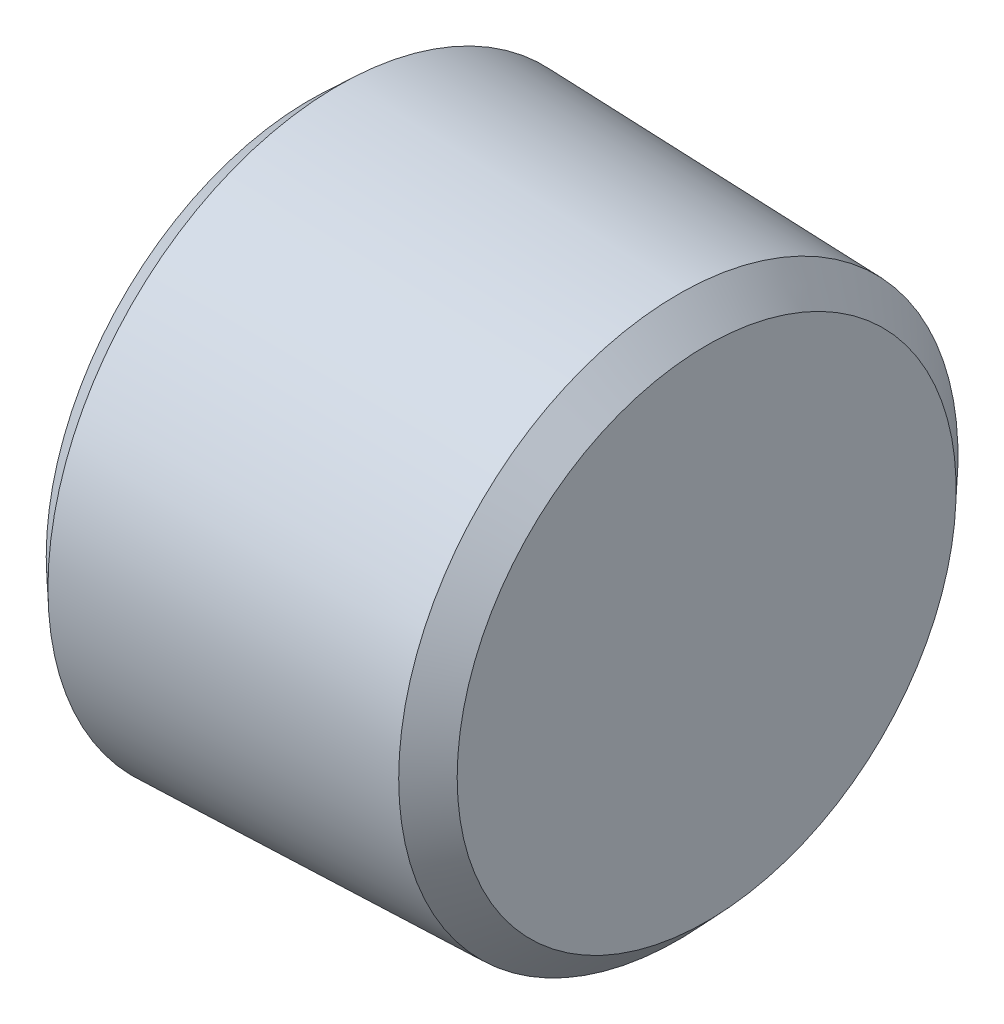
SolidWorks part; units mm, degrees
ref_plane "前视" through (0, 0, 0) normal (0, 0, 1) x (1, 0, 0)
ref_plane "上视" through (0, 0, 0) normal (0, 1, 0) x (1, 0, 0)
ref_plane "右视" through (0, 0, 0) normal (1, 0, 0) x (0, 0, -1)
sketch "草图1" plane through (0, 0, 0) normal (0, 0, 1) x (1, 0, 0)
  line L0 (0, 0) -> (22.0077, 0) construction
  line L1 (0, 0) -> (0, 4.6515)
  line L2 (0.4998, 5.121) -> (6.5002, 4.9335)
  line L3 (7, 4.4015) -> (7, 0)
  line L4 (7, 0) -> (0, 0)
  line L5 (7, 4.9179) -> (16.5, 4.621) construction
  line L6 (16.5, 4.621) -> (16.5, 0) construction
  line L7 (0, 4.6515) -> (0.4998, 5.121)
  line L8 (6.5002, 4.9335) -> (7, 4.4015)
  point P3 (0, 5.1366)
  point P6 (16.5, 0)
  dimension "D1" = 16.5
  dimension "D2" = 7
  dimension "D3" = 0.5
  dimension "D4" = 45
  dimension "D5" = 9.242
  dimension "D6" = 10.242
  dimension "D7" = 0.5
  dimension "D8" = 45
revolve "旋转1" add sketch "草图1" angle 360 about L0
sketch "草图2" plane through (0, 0, 0) normal (1, 0, 0) x (0, 0, -1)
  line L1 (0, 2.8868) -> (-2.5, 1.4434)
  line L2 (-2.5, 1.4434) -> (-2.5, -1.4434)
  line L3 (-2.5, -1.4434) -> (0, -2.8868)
  line L4 (0, -2.8868) -> (2.5, -1.4434)
  line L5 (2.5, -1.4434) -> (2.5, 1.4434)
  line L6 (2.5, 1.4434) -> (0, 2.8868)
  circle A0 centre (0, 0) radius 2.5 construction
  dimension "D1" = 5
extrude "切除-拉伸1" cut sketch "草图2" along normal blind 3.5
sketch "草图3" plane through (0, 0, 0) normal (0, 1, 0) x (1, 0, 0)
  line L0 (3.5, 0) -> (3.5, -2.5) construction
  line L1 (3.5, 0) -> (3.5, -2.5)
  line L2 (0, 0) -> (5.4455, 0) construction
  line L3 (0, 0) -> (22.0077, 0) construction
  line L4 (3.5, -2.5) -> (4.9434, 0)
  line L5 (4.9434, 0) -> (3.5, 0)
  dimension "D1" = 60
revolve "切除-旋转4" cut sketch "草图3" angle 360 about L2
